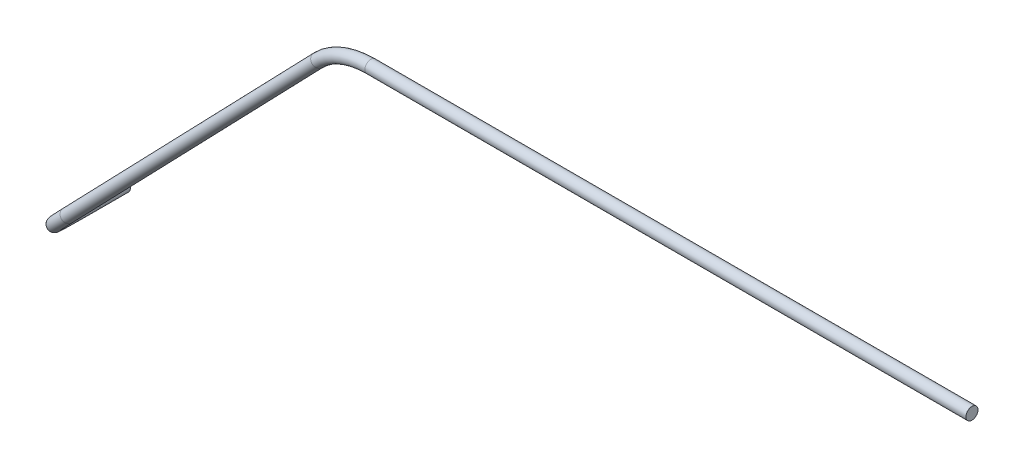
SolidWorks part; units mm, degrees
ref_plane "Front Plane" through (0, 0, 0) normal (0, 0, 1) x (1, 0, 0)
ref_plane "Top Plane" through (0, 0, 0) normal (0, 1, 0) x (1, 0, 0)
ref_plane "Right Plane" through (0, 0, 0) normal (1, 0, 0) x (0, 0, -1)
sketch "Sketch1" plane through (0, 0, 0) normal (0, 0, 1) x (1, 0, 0)
  circle A2 centre (0, 25.4) radius 4.7625
sketch3d "3DSketch1"
  line L0 (0, 25.4, 0) -> (0, 25.4, 23.8192)
  line L1 (38.9866, 65.683, 83.6896) -> (257.4796, 291.4411, 104.3675)
  line L2 (300.681, 309.7276, 106.0424) -> (775.1776, 309.7276, 106.0424)
  arc A0 (0, 25.4, 23.8192) -> (38.9866, 65.683, 83.6896) centre (41.727, 68.5145, 23.8192) ccw
  arc A1 (257.4796, 291.4411, 104.3675) -> (300.681, 309.7276, 106.0424) centre (300.681, 249.9777, 100.5698) ccw
  point P7 (0, 25.4, 80)
  point P8 (-1.3875, 110.2415, 23.8192)
  point P11 (275.1776, 309.7276, 106.0424)
  point P12 (300.681, 255.4504, 40.8199)
  dimension "D3" = 60
  dimension "D1" = 80
  dimension "D2" = 500
sweep "Sweep1" add profiles "Sketch1" path "3DSketch1"
